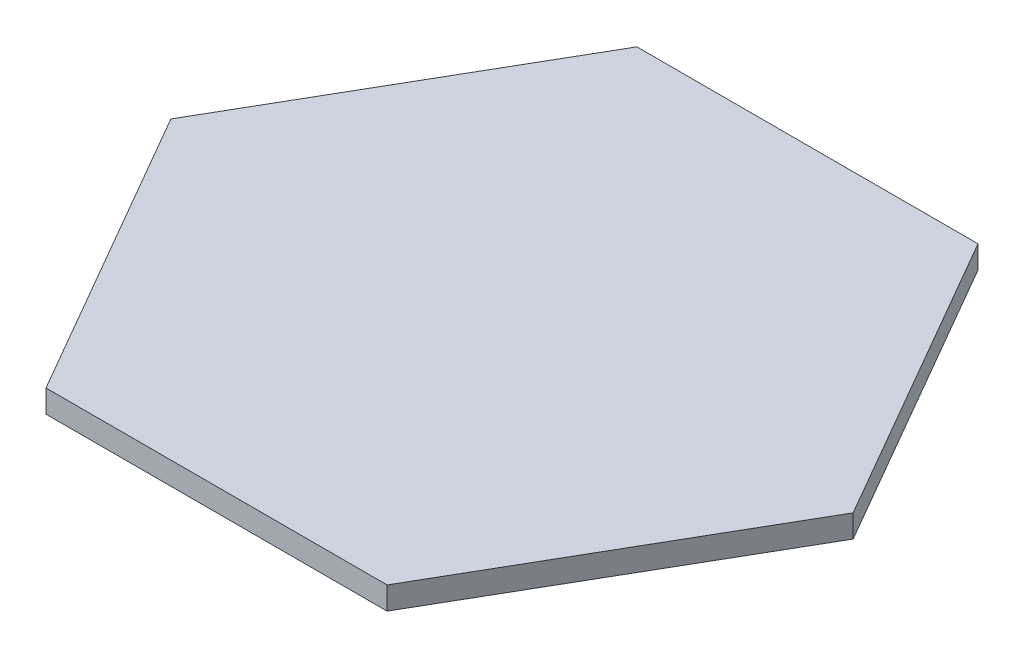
SolidWorks part; units mm, degrees
ref_plane "Front Plane" through (0, 0, 0) normal (0, 0, 1) x (1, 0, 0)
ref_plane "Top Plane" through (0, 0, 0) normal (0, 1, 0) x (1, 0, 0)
ref_plane "Right Plane" through (0, 0, 0) normal (1, 0, 0) x (0, 0, -1)
sketch "Sketch1" plane through (0, 0, 0) normal (0, 1, 0) x (1, 0, 0)
  line L0 (54.3639, -50.5343) -> (-54.3639, 50.5343) construction
  line L1 (-54.3639, 50.5343) -> (54.3639, 50.5343) construction
  line L2 (-54.3639, 50.5343) -> (-54.3639, -50.5343) construction
  line L3 (-54.3639, -50.5343) -> (54.3639, -50.5343) construction
  line L4 (54.3639, 50.5343) -> (54.3639, -50.5343) construction
  line L6 (54.3639, 0) -> (27.182, 47.0805)
  line L7 (27.182, 47.0805) -> (-27.182, 47.0805)
  line L8 (-27.182, 47.0805) -> (-54.3639, 0)
  line L9 (-54.3639, 0) -> (-27.182, -47.0805)
  line L10 (-27.182, -47.0805) -> (27.182, -47.0805)
  line L11 (27.182, -47.0805) -> (54.3639, 0)
  circle A0 centre (0, 0) radius 47.0805 construction
extrude "Extrude1" add sketch "Sketch1" along normal blind 3.6188
